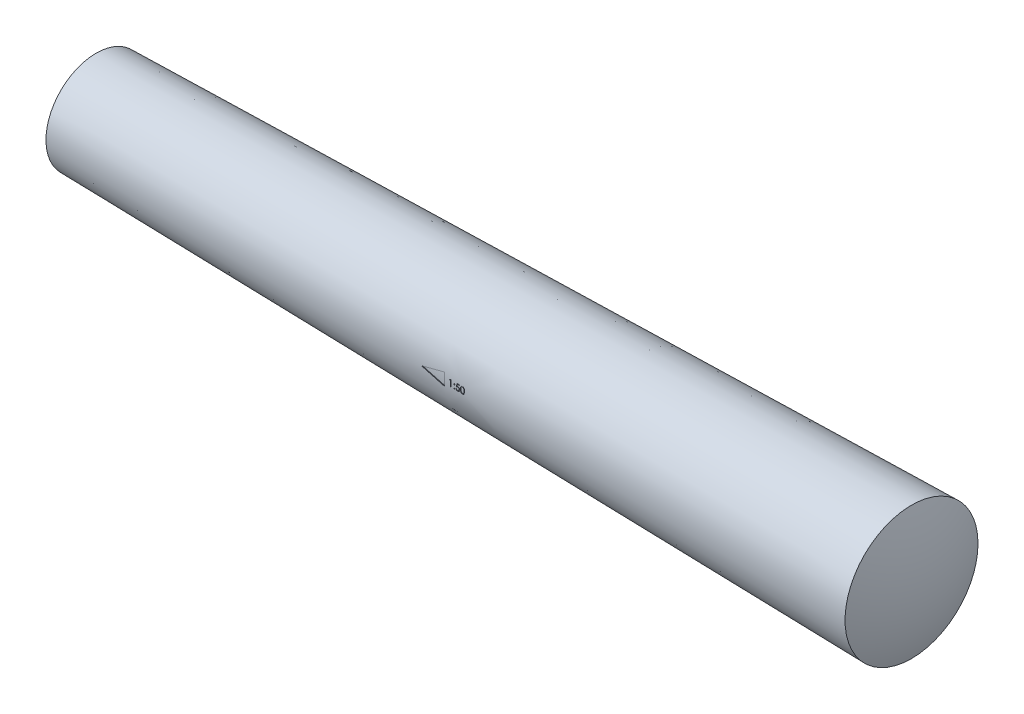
SolidWorks part; units mm, degrees
ref_plane "Front Plane" through (0, 0, 0) normal (0, 0, 1) x (1, 0, 0)
ref_plane "Top Plane" through (0, 0, 0) normal (0, 1, 0) x (1, 0, 0)
ref_plane "Right Plane" through (0, 0, 0) normal (1, 0, 0) x (0, 0, -1)
sketch "Sketch1" plane through (0, 0, 0) normal (1, 0, 0) x (0, 0, -1)
  circle A0 centre (0, 0) radius 8
  dimension "D1" = 16
extrude "Extrude1" add sketch "Sketch1" along normal mid plane 130
draft "Draft1" type of draft neutral plane draft angle 1.146 faces to draft 1 parameters "D1"=1.146
sketch "Sketch2" plane through (0, 0, 0) normal (0, 0, 1) x (1, 0, 0)
  line L0 (-65, 0) -> (-65, 8)
  line L1 (-65, 8) -> (-65, -8) construction
  line L2 (-65, 0) -> (-67, 0)
  line L3 (-67, 0) -> (-67, -9.3) construction
  line L4 (65, 0) -> (65, 10.6001)
  line L5 (65, -10.6001) -> (65, 10.6001) construction
  line L6 (65, 0) -> (67, 0)
  line L7 (67, 0) -> (67, -9.3) construction
  line L8 (-65, -8) -> (65, -10.6001) construction
  arc A0 (-67, 0) -> (-65, 8) centre (-50, 0) cw
  arc A1 (67, 0) -> (65, 10.6001) centre (37.9096, 0) ccw
  point P14 (0, -9.3)
revolve "Revolve1" add sketch "Sketch2" angle 360 about L2
sketch "Sketch5" plane through (0, 0, 0) normal (0, 0, 1) x (1, 0, 0)
  line L0 (0, 9.3) -> (0, -9.3) construction
  line L1 (65, 10.6001) -> (-65, 8) construction
  line L2 (-65, -8) -> (65, -10.6001) construction
ref_plane "Plane2" through (0, 0, 0) normal (-0.02, 0, 0.9998) x (0.9998, 0, 0.02)
sketch "Sketch6" plane through (0, 0, 0) normal (-0.02, 0, 0.9998) x (0.9998, 0, 0.02)
  line L0 (0, 0) -> (0, 1)
  line L1 (0, 9.3) -> (0, -9.3) construction
  line L2 (0, 1) -> (-3.7321, 0)
  line L3 (-3.7321, 0) -> (0, -1)
  line L4 (0, -1) -> (0, 0)
  line L5 (0, -0.5) -> (4, -0.5) construction
  text T0 "1:50" font "Century Gothic" height 1
  dimension "D1" = 2
  dimension "D2" = 30
  dimension "D3" = 4
wrap "Wrap2" sketch "Sketch6" wrap type deboss source sketch "Sketch6" thickness 0.1 parameters "D1"=0.1
equation "\"D2@Sketch2\" = \"D1@Sketch2\""
